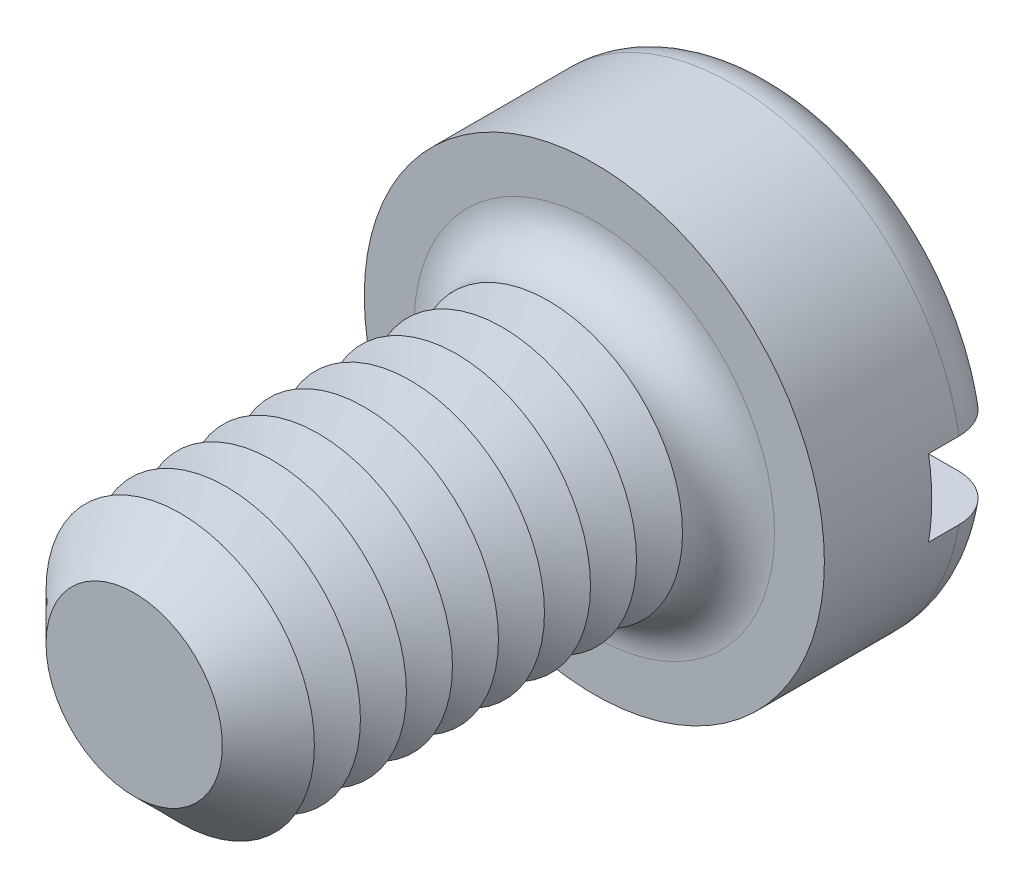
SolidWorks part; units mm, degrees
ref_plane "Front Plane" through (0, 0, 0) normal (0, 0, 1) x (1, 0, 0)
ref_plane "Top Plane" through (0, 0, 0) normal (0, 1, 0) x (1, 0, 0)
ref_plane "Right Plane" through (0, 0, 0) normal (1, 0, 0) x (0, 0, -1)
sketch "Sketch3" plane through (0, 0, 0) normal (0, 0, 1) x (1, 0, 0)
  circle A0 centre (0, 0) radius 3
  dimension "D1" = 6
extrude "Boss-Extrude2" add sketch "Sketch3" against normal blind 2.4
sketch "Sketch4" plane through (0, 0, 0) normal (0, 0, 1) x (1, 0, 0)
  circle A0 centre (0, 0) radius 1.75
  dimension "D1" = 3.5
extrude "Boss-Extrude3" add sketch "Sketch4" along normal blind 6
fillet "Fillet1" radius 0.6 2 edges at (3, 0, -2.4) (1.75, 0, 0)
chamfer "Chamfer1" distance 0.6 angle 45 1 edges at (1.75, 0, 6)
sketch "Sketch5" plane through (0, 0, 0) normal (1, 0, 0) x (0, 0, -1)
  line L0 (1.6944, 0) -> (-7.6738, 0) construction
sketch "Sketch6" plane through (0, 0, 0) normal (1, 0, 0) x (0, 0, -1)
  line L0 (-0.6, 1.75) -> (-0.9, 1.2304)
  line L1 (-0.9, 1.2304) -> (-1.2, 1.75)
  line L2 (-0.6, 1.75) -> (-5.4, 1.75) construction
  line L3 (-1.2, 1.75) -> (-0.6, 1.75)
  dimension "D1" = 0.6
revolve "Cut-Revolve1" cut sketch "Sketch6" angle 360 about L0
pattern_linear "LPattern1" count 8 spacing 0.6 along (0, 0, 1) of "Cut-Revolve1"
sketch "Sketch8" plane through (0, 0, -2.4) normal (0, 0, -1) x (-1, 0, 0)
  line L1 (3, -0.5) -> (-3, -0.5)
  line L2 (3, -0.5) -> (3, 0.5)
  line L3 (3, 0.5) -> (-3, 0.5)
  line L4 (-3, -0.5) -> (-3, 0.5)
  line L5 (3, -0.5) -> (-3, 0.5) construction
  line L6 (3, 0.5) -> (-3, -0.5) construction
  point P0 (0, 0)
  dimension "D1" = 6
  dimension "D2" = 1
extrude "Cut-Extrude1" cut sketch "Sketch8" against normal blind 1
